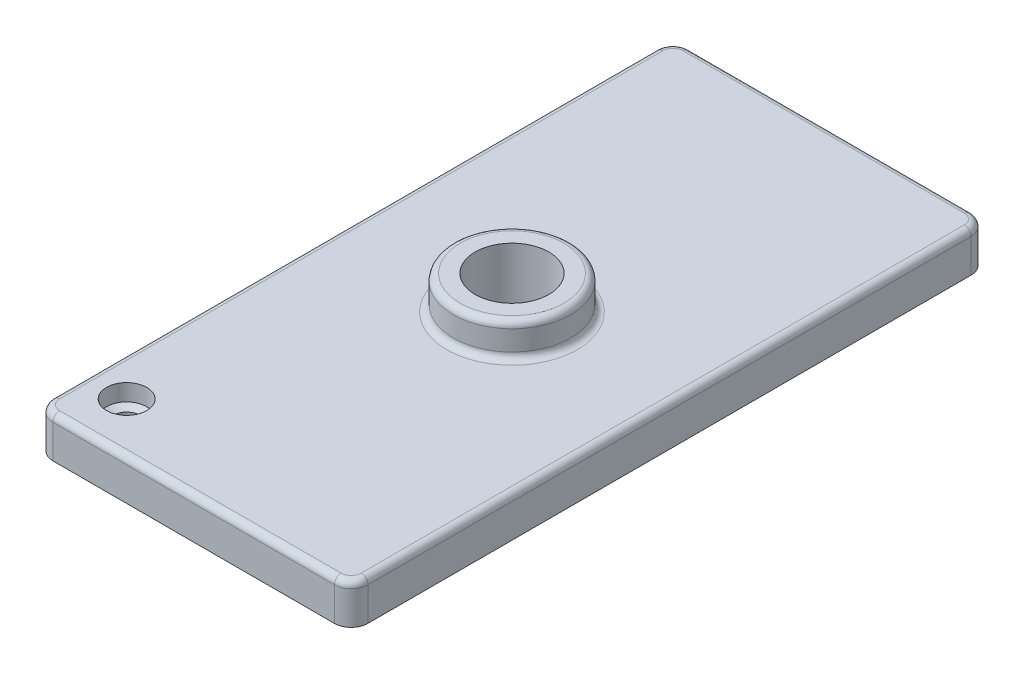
SolidWorks part; units mm, degrees
ref_plane "Front" through (0, 0, 0) normal (0, 0, 1) x (1, 0, 0)
ref_plane "Top" through (0, 0, 0) normal (0, 1, 0) x (1, 0, 0)
ref_plane "Right" through (0, 0, 0) normal (1, 0, 0) x (0, 0, -1)
sketch "Sketch1" plane through (0, 0, 0) normal (0, 1, 0) x (1, 0, 0)
  line L0 (-47, 95) -> (47, -95) construction
  line L1 (-47, -95) -> (47, -95)
  line L2 (-47, -95) -> (-47, 95)
  line L3 (-47, 95) -> (47, 95)
  line L4 (47, -95) -> (47, 95)
  dimension "D1" = 190
  dimension "D2" = 94
extrude "plate" add sketch "Sketch1" along normal blind 12
sketch "Sketch2" plane through (0, 12, 0) normal (0, 1, 0) x (-1, 0, 0)
  circle A0 centre (0, 0) radius 17.5
  dimension "D1" = 35
extrude "boss" add sketch "Sketch2" along normal blind 10
sketch "Sketch3" plane through (0, 22, 0) normal (0, 1, 0) x (-1, 0, 0)
  circle A0 centre (0, 0) radius 11
  dimension "D1" = 22
extrude "center hole" cut sketch "Sketch3" against normal through all
hole_wizard "pattern hole" positions "Sketch5" profile "Sketch4" legacy
sketch "Sketch5" plane through (0, 12, 0) normal (0, 1, 0) x (-1, 0, 0)
  line L0 (47, 95) -> (-47, 95) construction
  line L1 (47, -95) -> (47, 95) construction
  point P0 (35, 80)
  dimension "D1" = 15
  dimension "D2" = 12
sketch "Sketch4" plane through (-35, 12, 80) normal (1, 0, 0) x (0, 0, 1)
  line L0 (0, 0) -> (0, 12)
  line L1 (0, 12) -> (4, 12)
  line L2 (4, 12) -> (4, 6.2017)
  line L3 (4, 6.2017) -> (6, 5)
  line L4 (6, 5) -> (6, 0)
  line L5 (6, 0) -> (0, 0)
  line L6 (0, -6.13) -> (0, 109.2824) construction
  line L7 (-4, 6.2017) -> (-6, 5) construction
  line L8 (0, 12) -> (-4, 12) construction
  dimension "Diameter" = 8
  dimension "Depth" = 12
  dimension "C-Drill Diameter" = 12
  dimension "C-Drill Depth" = 5
  dimension "C-Drill Angle" = 118
fillet "R5" radius 5 4 edges at (-47, 6, -95) (47, 6, -95) (47, 6, 95) (-47, 6, 95)
fillet "R2" radius 2 10 edges at (0, 12, -17.5) (0, 22, 17.5) (47, 12, 0) (0, 12, 95) (-47, 12, 0) (0, 12, -95) (45.5355, 12, -93.5355) (-45.5355, 12, -93.5355) (-45.5355, 12, 93.5355) (45.5355, 12, 93.5355)
